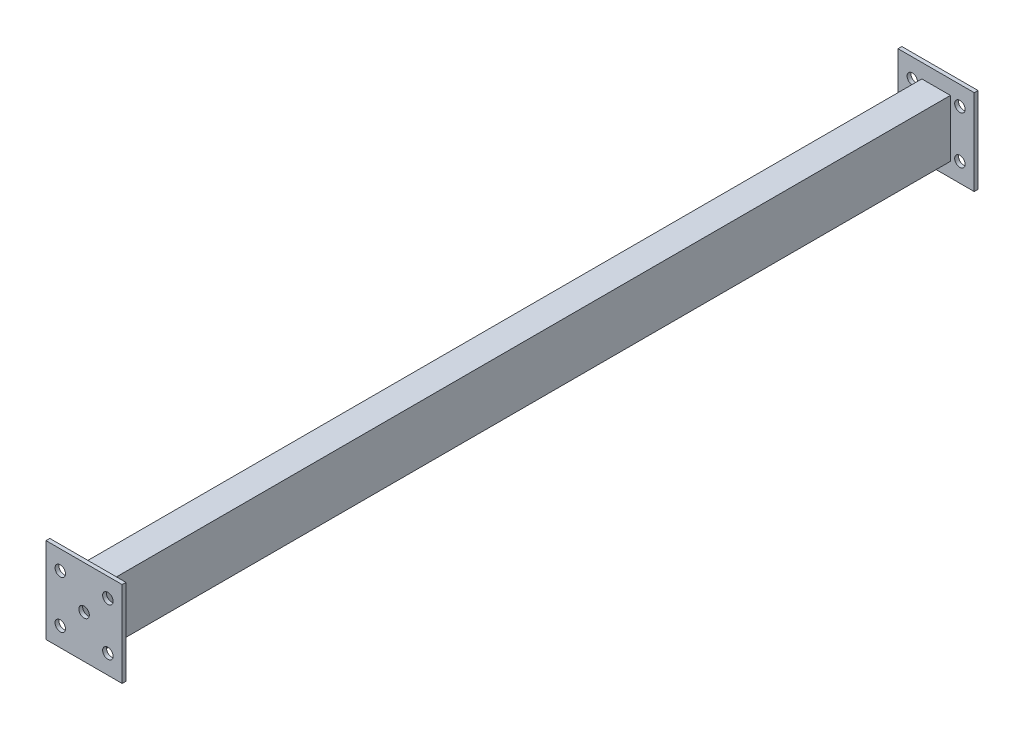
SolidWorks part; units mm, degrees
ref_plane "Plan de face" through (0, 0, 0) normal (0, 0, 1) x (1, 0, 0)
ref_plane "Plan de dessus" through (0, 0, 0) normal (0, 1, 0) x (1, 0, 0)
ref_plane "Plan de droite" through (0, 0, 0) normal (1, 0, 0) x (0, 0, -1)
sketch "Esquisse1" plane through (0, 0, 0) normal (0, 0, 1) x (1, 0, 0)
  line L1 (-12.5, 27.5) -> (12.5, 27.5)
  line L2 (-12.5, 27.5) -> (-12.5, -27.5)
  line L3 (-12.5, -27.5) -> (12.5, -27.5)
  line L4 (12.5, 27.5) -> (12.5, -27.5)
  line L5 (-15, 30) -> (15, 30)
  line L6 (-15, 30) -> (-15, -30)
  line L7 (-15, -30) -> (15, -30)
  line L8 (15, 30) -> (15, -30)
  dimension "D1" = 60
  dimension "D2" = 30
  dimension "D3" = 15
  dimension "D4" = 30
  dimension "D5" = 55
  dimension "D6" = 27.5
  dimension "D7" = 25
  dimension "D8" = 12.5
extrude "Extrusion1" add sketch "Esquisse1" along normal blind 445.5
sketch "Esquisse2" plane through (0, 0, 445.5) normal (0, 0, 1) x (1, 0, 0)
  line L1 (-40, 45) -> (40, 45)
  line L2 (-40, 45) -> (-40, -45)
  line L3 (-40, -45) -> (40, -45)
  line L4 (40, 45) -> (40, -45)
  circle A0 centre (-25, 25) radius 5.5
  circle A1 centre (25, 25) radius 5.5
  circle A2 centre (-25, -25) radius 5.5
  circle A3 centre (25, -25) radius 5.5
  circle A4 centre (0, 0) radius 5.5
  dimension "D6" = 50
  dimension "D7" = 25
  dimension "D8" = 50
  dimension "D9" = 11
  dimension "D10" = 11
  dimension "D11" = 11
  dimension "D12" = 11
  dimension "D13" = 11
  dimension "D1" = 40
  dimension "D2" = 80
  dimension "D3" = 90
  dimension "D4" = 45
  dimension "D5" = 25
extrude "Extrusion2" add sketch "Esquisse2" along normal blind 4
mirror "Symétrie1" about plane through (-15, -30, 0) normal (0, 0, 1) of "Extrusion1", "Extrusion2"
